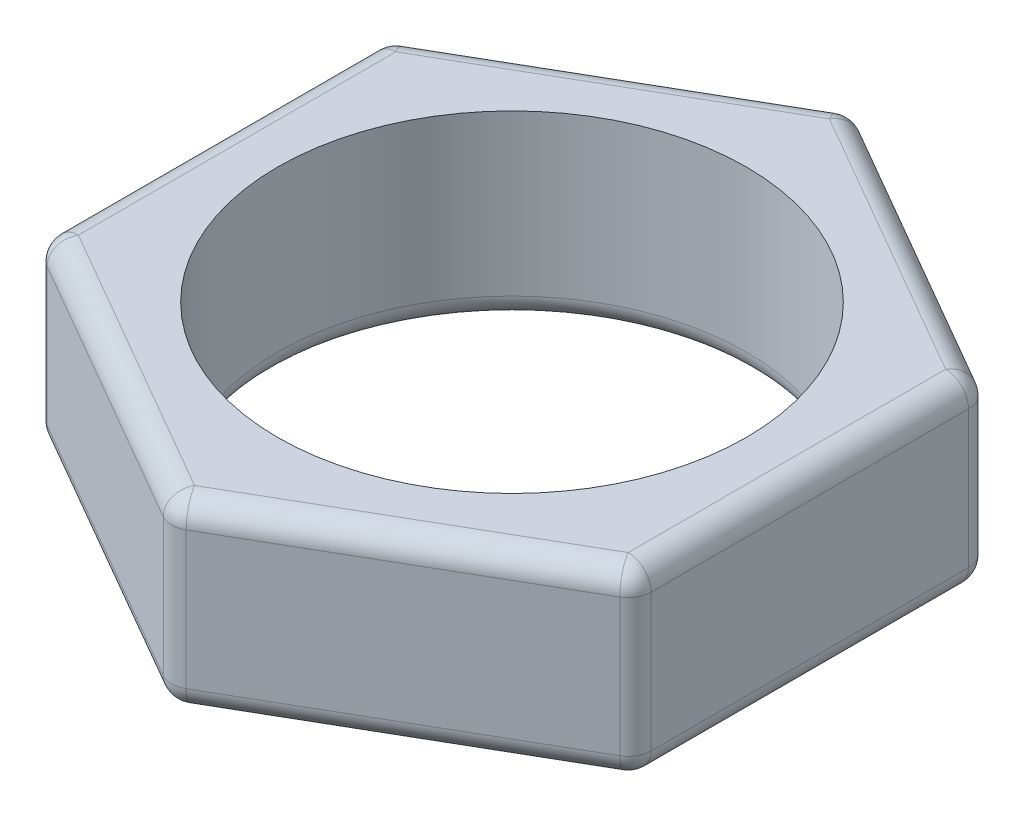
SolidWorks part; units mm, degrees
ref_plane "Płaszczyzna przednia" through (0, 0, 0) normal (0, 0, 1) x (1, 0, 0)
ref_plane "Płaszczyzna górna" through (0, 0, 0) normal (0, 1, 0) x (1, 0, 0)
ref_plane "Płaszczyzna prawa" through (0, 0, 0) normal (1, 0, 0) x (0, 0, -1)
sketch "Szkic1" plane through (0, 0, 0) normal (0, 1, 0) x (1, 0, 0)
  line L1 (0, -7.5056) -> (6.5, -3.7528)
  line L2 (6.5, -3.7528) -> (6.5, 3.7528)
  line L3 (6.5, 3.7528) -> (0, 7.5056)
  line L4 (0, 7.5056) -> (-6.5, 3.7528)
  line L5 (-6.5, 3.7528) -> (-6.5, -3.7528)
  line L6 (-6.5, -3.7528) -> (0, -7.5056)
  circle A0 centre (0, 0) radius 5.1135
  circle A1 centre (0, 0) radius 6.5 construction
  dimension "D1" = 13
extrude "Dodanie-wyciągnięcie1" add sketch "Szkic1" along normal blind 4
fillet "Zaokrąglenie1" radius 0.5 19 edges at (-3.25, 4, 5.6292) (-3.25, 0, 5.6292) (-6.5, 4, 0) (-6.5, 2, 3.7528) (-6.5, 0, 0) (-3.25, 4, -5.6292) (-6.5, 2, -3.7528) (-3.25, 0, -5.6292) (3.25, 4, -5.6292) (0, 2, -7.5056) (3.25, 0, -5.6292) (6.5, 4, 0) (6.5, 2, -3.7528) (6.5, 0, 0) (0, 2, 7.5056) (3.25, 4, 5.6292) (6.5, 2, 3.7528) (3.25, 0, 5.6292) (0, 0, 5.1135)
